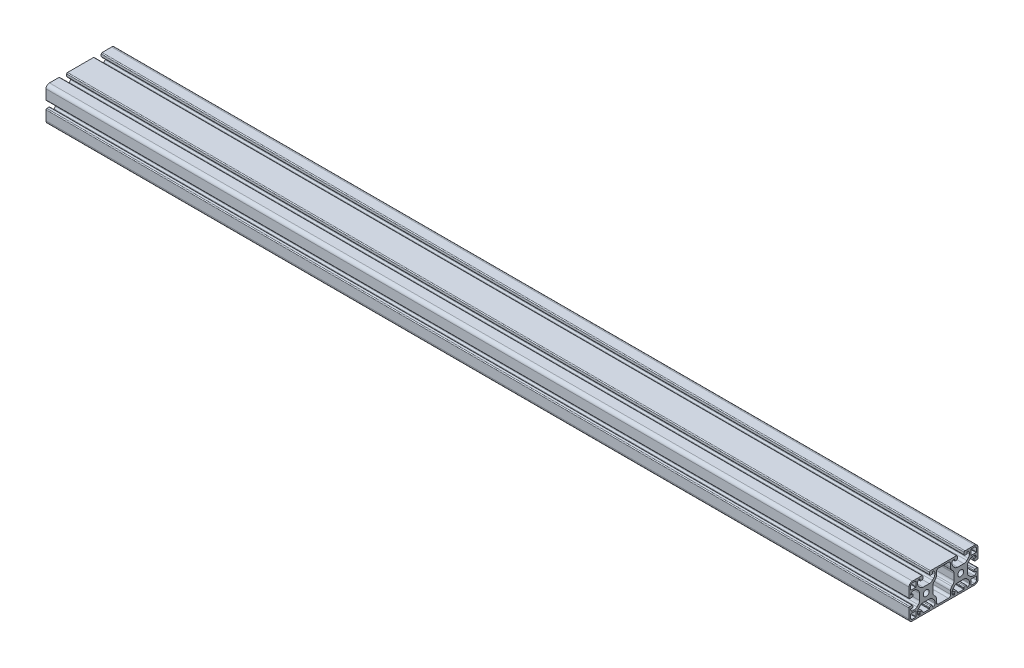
SolidWorks part; units mm, degrees
ref_plane "Ebene vorne" through (0, 0, 0) normal (0, 0, 1) x (1, 0, 0)
ref_plane "Ebene oben" through (0, 0, 0) normal (0, 1, 0) x (1, 0, 0)
ref_plane "Ebene rechts" through (0, 0, 0) normal (1, 0, 0) x (0, 0, -1)
sketch "Skizze1" plane through (0, 0, 0) normal (0, 1, 0) x (1, 0, 0)
  line L0 (0, 0) -> (1000, 0)
  dimension "D1" = 1000
other "Strukturbauteil1"
ref_plane "Ebene3" through (0, 0, 0) normal (1, 0, 0) x (0, 0, -1)
sketch "Model" plane through (0, 0, 0) normal (1, 0, 0) x (0, 0, -1)
  line L0 (-40, 0) -> (40, 0) construction
  line L1 (-20, 20) -> (-20, -20) construction
  line L2 (20, 20) -> (20, -20) construction
  line L3 (10.7855, 7.0931) -> (9.6645, 8.2142)
  line L4 (12.9069, 9.2145) -> (11.4645, 10.6569)
  line L5 (-29.2145, 7.0931) -> (-30.6569, 8.5355)
  line L6 (-11.4645, -10.6569) -> (-12.9069, -9.2145)
  line L7 (-27.0931, 9.2145) -> (-28.5355, 10.6569)
  line L8 (-9.6645, -8.2142) -> (-10.7855, -7.0931)
  line L9 (28.5355, -10.6569) -> (27.0931, -9.2145)
  line L10 (30.6569, -8.5355) -> (29.2145, -7.0931)
  line L11 (-36, -20) -> (36, -20)
  line L12 (32.3, -18.2) -> (36, -18.2)
  line L13 (-36, -18.2) -> (-32.3, -18.2)
  line L14 (-5.7, -18) -> (5.7, -18)
  line L15 (16.5, -18) -> (23.5, -18)
  line L16 (-23.5, -18) -> (-16.5, -18)
  line L17 (13.5, -15.5) -> (15, -15.5)
  line L18 (25, -15.5) -> (26.5, -15.5)
  line L19 (-26.5, -15.5) -> (-25, -15.5)
  line L20 (-15, -15.5) -> (-13.5, -15.5)
  line L21 (32.3, -11.8) -> (37.7, -11.8)
  line L22 (-37.7, -11.8) -> (-32.3, -11.8)
  line L23 (-35.5, -10) -> (-34.1924, -10)
  line L24 (34.1924, -10) -> (35.5, -10)
  line L25 (16.4424, -7.75) -> (23.5576, -7.75)
  line L26 (-23.5576, -7.75) -> (-16.4424, -7.75)
  line L27 (-37.55, -7) -> (-36, -7)
  line L28 (36, -7) -> (37.55, -7)
  line L29 (-39, -4) -> (-36.5, -4)
  line L30 (36.5, -4) -> (39, -4)
  line L31 (-39, 4) -> (-36.5, 4)
  line L32 (36.5, 4) -> (39, 4)
  line L33 (-37.55, 7) -> (-36, 7)
  line L34 (36, 7) -> (37.55, 7)
  line L35 (-23.5576, 7.75) -> (-16.4424, 7.75)
  line L36 (16.4424, 7.75) -> (23.5576, 7.75)
  line L37 (-35.5, 10) -> (-34.1924, 10)
  line L38 (34.1924, 10) -> (35.5, 10)
  line L39 (-37.7, 11.8) -> (-32.3, 11.8)
  line L40 (32.3, 11.8) -> (37.7, 11.8)
  line L41 (-15, 15.5) -> (-13.5, 15.5)
  line L42 (-26.5, 15.5) -> (-25, 15.5)
  line L43 (25, 15.5) -> (26.5, 15.5)
  line L44 (13.5, 15.5) -> (15, 15.5)
  line L45 (-12.55, 18) -> (-12.5, 18)
  line L46 (-27.5, 18) -> (-27.45, 18)
  line L47 (27.45, 18) -> (27.5, 18)
  line L48 (12.5, 18) -> (12.55, 18)
  line L49 (-5.7, 18) -> (5.7, 18)
  line L50 (-36, 18.2) -> (-32.3, 18.2)
  line L51 (32.3, 18.2) -> (36, 18.2)
  line L52 (-15, 20) -> (15, 20)
  line L53 (-36, 20) -> (-25, 20)
  line L54 (25, 20) -> (36, 20)
  line L55 (27.0931, 9.2145) -> (28.5355, 10.6569)
  line L56 (-28.5355, -10.6569) -> (-27.0931, -9.2145)
  line L57 (9.6645, -8.2142) -> (10.7855, -7.0931)
  line L58 (-12.9069, 9.2145) -> (-11.4645, 10.6569)
  line L59 (-30.6569, -8.5355) -> (-29.2145, -7.0931)
  line L60 (11.4645, -10.6569) -> (12.9069, -9.2145)
  line L61 (-10.7855, 7.0931) -> (-9.6645, 8.2142)
  line L62 (29.2145, 7.0931) -> (30.6569, 8.5355)
  line L63 (-40, 5) -> (-40, 16)
  line L64 (-40, -16) -> (-40, -5)
  line L65 (-38.2, 12.3) -> (-38.2, 16)
  line L66 (-38.2, -16) -> (-38.2, -12.3)
  line L67 (-38, 7.45) -> (-38, 7.5)
  line L68 (-38, -7.5) -> (-38, -7.45)
  line L69 (-35.5, 5) -> (-35.5, 6.5)
  line L70 (-35.5, -6.5) -> (-35.5, -5)
  line L71 (-31.8, 12.3) -> (-31.8, 17.7)
  line L72 (-31.8, -17.7) -> (-31.8, -12.3)
  line L73 (-30, 14.1924) -> (-30, 15.5)
  line L74 (-30, -15.5) -> (-30, -14.1924)
  line L75 (-27.75, -3.5576) -> (-27.75, 3.5576)
  line L76 (-27, 16) -> (-27, 17.55)
  line L77 (-27, -17.5) -> (-27, -16)
  line L78 (-24, 16.5) -> (-24, 19)
  line L79 (-24, -17.5) -> (-24, -16.5)
  line L80 (-16, 16.5) -> (-16, 19)
  line L81 (-16, -17.5) -> (-16, -16.5)
  line L82 (-13, 16) -> (-13, 17.55)
  line L83 (-13, -17.5) -> (-13, -16)
  line L84 (-12.25, -3.5576) -> (-12.25, 3.5576)
  line L85 (-10, 14.1924) -> (-10, 15.5)
  line L86 (-10, -15.5) -> (-10, -14.1924)
  line L87 (-8.2, 11.7497) -> (-8.2, 15.5)
  line L88 (-8.2, -15.5) -> (-8.2, -11.7497)
  line L89 (8.2, 11.7497) -> (8.2, 15.5)
  line L90 (8.2, -15.5) -> (8.2, -11.7497)
  line L91 (10, 14.1924) -> (10, 15.5)
  line L92 (10, -15.5) -> (10, -14.1924)
  line L93 (12.25, -3.5576) -> (12.25, 3.5576)
  line L94 (13, 16) -> (13, 17.55)
  line L95 (13, -17.5) -> (13, -16)
  line L96 (16, 16.5) -> (16, 19)
  line L97 (16, -17.5) -> (16, -16.5)
  line L98 (24, 16.5) -> (24, 19)
  line L99 (24, -17.5) -> (24, -16.5)
  line L100 (27, 16) -> (27, 17.55)
  line L101 (27, -17.5) -> (27, -16)
  line L102 (27.75, -3.5576) -> (27.75, 3.5576)
  line L103 (30, 14.1924) -> (30, 15.5)
  line L104 (30, -15.5) -> (30, -14.1924)
  line L105 (31.8, -17.7) -> (31.8, -12.3)
  line L106 (31.8, 12.3) -> (31.8, 17.7)
  line L107 (35.5, -6.5) -> (35.5, -5)
  line L108 (35.5, 5) -> (35.5, 6.5)
  line L109 (38, -7.5) -> (38, -7.45)
  line L110 (38, 7.45) -> (38, 7.5)
  line L111 (38.2, -16) -> (38.2, -12.3)
  line L112 (38.2, 12.3) -> (38.2, 16)
  line L113 (40, -16) -> (40, -5)
  line L114 (40, 5) -> (40, 16)
  line L116 (-40, 20) -> (40, 20) construction
  line L117 (-40, 20) -> (-40, -20) construction
  line L118 (-40, -20) -> (40, -20) construction
  line L119 (40, 20) -> (40, -20) construction
  line L120 (-40, 20) -> (40, -20) construction
  line L121 (-40, -20) -> (40, 20) construction
  arc A0 (-39, -4) -> (-40, -5) centre (-39, -5) ccw
  arc A1 (-40, 5) -> (-39, 4) centre (-39, 5) ccw
  arc A2 (-37.7, -11.8) -> (-38.2, -12.3) centre (-37.7, -12.3) ccw
  arc A3 (-38.2, 12.3) -> (-37.7, 11.8) centre (-37.7, 12.3) ccw
  arc A4 (-37.55, -7) -> (-38, -7.45) centre (-37.55, -7.45) ccw
  arc A5 (-38, 7.45) -> (-37.55, 7) centre (-37.55, 7.45) ccw
  arc A6 (-35.5, -5) -> (-36.5, -4) centre (-36.5, -5) ccw
  arc A7 (-36.5, 4) -> (-35.5, 5) centre (-36.5, 5) ccw
  arc A8 (-38.2, -16) -> (-36, -18.2) centre (-36, -16) ccw
  arc A9 (-40, -16) -> (-36, -20) centre (-36, -16) ccw
  arc A10 (-36, -7) -> (-35.5, -6.5) centre (-36, -6.5) ccw
  arc A11 (-35.5, 6.5) -> (-36, 7) centre (-36, 6.5) ccw
  arc A12 (-36, 18.2) -> (-38.2, 16) centre (-36, 16) ccw
  arc A13 (-36, 20) -> (-40, 16) centre (-36, 16) ccw
  arc A14 (-38, -7.5) -> (-35.5, -10) centre (-35.5, -7.5) ccw
  arc A15 (-35.5, 10) -> (-38, 7.5) centre (-35.5, 7.5) ccw
  arc A16 (-34.1924, -10) -> (-30.6569, -8.5355) centre (-34.1924, -5) ccw
  arc A17 (-30.6569, 8.5355) -> (-34.1924, 10) centre (-34.1924, 5) ccw
  arc A18 (-29.2145, -7.0931) -> (-27.75, -3.5576) centre (-32.75, -3.5576) ccw
  arc A19 (-27.75, 3.5576) -> (-29.2145, 7.0931) centre (-32.75, 3.5576) ccw
  arc A20 (-32.3, -18.2) -> (-31.8, -17.7) centre (-32.3, -17.7) ccw
  arc A21 (-31.8, -12.3) -> (-32.3, -11.8) centre (-32.3, -12.3) ccw
  arc A22 (-32.3, 11.8) -> (-31.8, 12.3) centre (-32.3, 12.3) ccw
  arc A23 (-31.8, 17.7) -> (-32.3, 18.2) centre (-32.3, 17.7) ccw
  arc A24 (-27.5, -18) -> (-27, -17.5) centre (-27.5, -17.5) ccw
  arc A25 (-30, -15.5) -> (-27.5, -18) centre (-27.5, -15.5) ccw
  arc A26 (-27.5, 18) -> (-30, 15.5) centre (-27.5, 15.5) ccw
  arc A27 (-27, 17.55) -> (-27.45, 18) centre (-27.45, 17.55) ccw
  arc A28 (-26.5, -15.5) -> (-27, -16) centre (-26.5, -16) ccw
  arc A29 (-27, 16) -> (-26.5, 15.5) centre (-26.5, 16) ccw
  arc A30 (-24, -16.5) -> (-25, -15.5) centre (-25, -16.5) ccw
  arc A31 (-28.5355, -10.6569) -> (-30, -14.1924) centre (-25, -14.1924) ccw
  arc A32 (-30, 14.1924) -> (-28.5355, 10.6569) centre (-25, 14.1924) ccw
  arc A33 (-25, 15.5) -> (-24, 16.5) centre (-25, 16.5) ccw
  arc A34 (-24, 19) -> (-25, 20) centre (-25, 19) ccw
  arc A35 (-23.5576, -7.75) -> (-27.0931, -9.2145) centre (-23.5576, -12.75) ccw
  arc A36 (-27.0931, 9.2145) -> (-23.5576, 7.75) centre (-23.5576, 12.75) ccw
  arc A37 (-24, -17.5) -> (-23.5, -18) centre (-23.5, -17.5) ccw
  circle A38 centre (-20, 0) radius 3.4
  arc A39 (-16.5, -18) -> (-16, -17.5) centre (-16.5, -17.5) ccw
  arc A40 (-12.9069, -9.2145) -> (-16.4424, -7.75) centre (-16.4424, -12.75) ccw
  arc A41 (-16.4424, 7.75) -> (-12.9069, 9.2145) centre (-16.4424, 12.75) ccw
  arc A42 (-15, -15.5) -> (-16, -16.5) centre (-15, -16.5) ccw
  arc A43 (-10, -14.1924) -> (-11.4645, -10.6569) centre (-15, -14.1924) ccw
  arc A44 (-11.4645, 10.6569) -> (-10, 14.1924) centre (-15, 14.1924) ccw
  arc A45 (-16, 16.5) -> (-15, 15.5) centre (-15, 16.5) ccw
  arc A46 (-15, 20) -> (-16, 19) centre (-15, 19) ccw
  arc A47 (-13, -16) -> (-13.5, -15.5) centre (-13.5, -16) ccw
  arc A48 (-13.5, 15.5) -> (-13, 16) centre (-13.5, 16) ccw
  arc A49 (-8.2, -11.7497) -> (-9.6645, -8.2142) centre (-13.2, -11.7497) ccw
  arc A50 (-9.6645, 8.2142) -> (-8.2, 11.7497) centre (-13.2, 11.7497) ccw
  arc A51 (-12.55, 18) -> (-13, 17.55) centre (-12.55, 17.55) ccw
  arc A52 (-13, -17.5) -> (-12.5, -18) centre (-12.5, -17.5) ccw
  arc A53 (-12.5, -18) -> (-10, -15.5) centre (-12.5, -15.5) ccw
  arc A54 (-10, 15.5) -> (-12.5, 18) centre (-12.5, 15.5) ccw
  arc A55 (-12.25, -3.5576) -> (-10.7855, -7.0931) centre (-7.25, -3.5576) ccw
  arc A56 (-10.7855, 7.0931) -> (-12.25, 3.5576) centre (-7.25, 3.5576) ccw
  arc A57 (-8.2, -15.5) -> (-5.7, -18) centre (-5.7, -15.5) ccw
  arc A58 (-5.7, 18) -> (-8.2, 15.5) centre (-5.7, 15.5) ccw
  arc A59 (5.7, -18) -> (8.2, -15.5) centre (5.7, -15.5) ccw
  arc A60 (8.2, 15.5) -> (5.7, 18) centre (5.7, 15.5) ccw
  arc A61 (10.7855, -7.0931) -> (12.25, -3.5576) centre (7.25, -3.5576) ccw
  arc A62 (12.25, 3.5576) -> (10.7855, 7.0931) centre (7.25, 3.5576) ccw
  arc A63 (12.5, -18) -> (13, -17.5) centre (12.5, -17.5) ccw
  arc A64 (10, -15.5) -> (12.5, -18) centre (12.5, -15.5) ccw
  arc A65 (12.5, 18) -> (10, 15.5) centre (12.5, 15.5) ccw
  arc A66 (13, 17.55) -> (12.55, 18) centre (12.55, 17.55) ccw
  arc A67 (9.6645, -8.2142) -> (8.2, -11.7497) centre (13.2, -11.7497) ccw
  arc A68 (8.2, 11.7497) -> (9.6645, 8.2142) centre (13.2, 11.7497) ccw
  arc A69 (13.5, -15.5) -> (13, -16) centre (13.5, -16) ccw
  arc A70 (13, 16) -> (13.5, 15.5) centre (13.5, 16) ccw
  arc A71 (16, -16.5) -> (15, -15.5) centre (15, -16.5) ccw
  arc A72 (11.4645, -10.6569) -> (10, -14.1924) centre (15, -14.1924) ccw
  arc A73 (10, 14.1924) -> (11.4645, 10.6569) centre (15, 14.1924) ccw
  arc A74 (15, 15.5) -> (16, 16.5) centre (15, 16.5) ccw
  arc A75 (16, 19) -> (15, 20) centre (15, 19) ccw
  arc A76 (16.4424, -7.75) -> (12.9069, -9.2145) centre (16.4424, -12.75) ccw
  arc A77 (12.9069, 9.2145) -> (16.4424, 7.75) centre (16.4424, 12.75) ccw
  arc A78 (16, -17.5) -> (16.5, -18) centre (16.5, -17.5) ccw
  circle A79 centre (20, 0) radius 3.4
  arc A80 (23.5, -18) -> (24, -17.5) centre (23.5, -17.5) ccw
  arc A81 (27.0931, -9.2145) -> (23.5576, -7.75) centre (23.5576, -12.75) ccw
  arc A82 (23.5576, 7.75) -> (27.0931, 9.2145) centre (23.5576, 12.75) ccw
  arc A83 (25, -15.5) -> (24, -16.5) centre (25, -16.5) ccw
  arc A84 (30, -14.1924) -> (28.5355, -10.6569) centre (25, -14.1924) ccw
  arc A85 (28.5355, 10.6569) -> (30, 14.1924) centre (25, 14.1924) ccw
  arc A86 (24, 16.5) -> (25, 15.5) centre (25, 16.5) ccw
  arc A87 (25, 20) -> (24, 19) centre (25, 19) ccw
  arc A88 (27, -16) -> (26.5, -15.5) centre (26.5, -16) ccw
  arc A89 (26.5, 15.5) -> (27, 16) centre (26.5, 16) ccw
  arc A90 (27.45, 18) -> (27, 17.55) centre (27.45, 17.55) ccw
  arc A91 (27, -17.5) -> (27.5, -18) centre (27.5, -17.5) ccw
  arc A92 (27.5, -18) -> (30, -15.5) centre (27.5, -15.5) ccw
  arc A93 (30, 15.5) -> (27.5, 18) centre (27.5, 15.5) ccw
  arc A94 (31.8, -17.7) -> (32.3, -18.2) centre (32.3, -17.7) ccw
  arc A95 (32.3, -11.8) -> (31.8, -12.3) centre (32.3, -12.3) ccw
  arc A96 (31.8, 12.3) -> (32.3, 11.8) centre (32.3, 12.3) ccw
  arc A97 (32.3, 18.2) -> (31.8, 17.7) centre (32.3, 17.7) ccw
  arc A98 (27.75, -3.5576) -> (29.2145, -7.0931) centre (32.75, -3.5576) ccw
  arc A99 (29.2145, 7.0931) -> (27.75, 3.5576) centre (32.75, 3.5576) ccw
  arc A100 (30.6569, -8.5355) -> (34.1924, -10) centre (34.1924, -5) ccw
  arc A101 (34.1924, 10) -> (30.6569, 8.5355) centre (34.1924, 5) ccw
  arc A102 (35.5, -10) -> (38, -7.5) centre (35.5, -7.5) ccw
  arc A103 (38, 7.5) -> (35.5, 10) centre (35.5, 7.5) ccw
  arc A104 (36, -18.2) -> (38.2, -16) centre (36, -16) ccw
  arc A105 (36, -20) -> (40, -16) centre (36, -16) ccw
  arc A106 (35.5, -6.5) -> (36, -7) centre (36, -6.5) ccw
  arc A107 (36, 7) -> (35.5, 6.5) centre (36, 6.5) ccw
  arc A108 (38.2, 16) -> (36, 18.2) centre (36, 16) ccw
  arc A109 (40, 16) -> (36, 20) centre (36, 16) ccw
  arc A110 (36.5, -4) -> (35.5, -5) centre (36.5, -5) ccw
  arc A111 (35.5, 5) -> (36.5, 4) centre (36.5, 5) ccw
  arc A112 (38, -7.45) -> (37.55, -7) centre (37.55, -7.45) ccw
  arc A113 (37.55, 7) -> (38, 7.45) centre (37.55, 7.45) ccw
  arc A114 (38.2, -12.3) -> (37.7, -11.8) centre (37.7, -12.3) ccw
  arc A115 (37.7, 11.8) -> (38.2, 12.3) centre (37.7, 12.3) ccw
  arc A116 (40, -5) -> (39, -4) centre (39, -5) ccw
  arc A117 (39, 4) -> (40, 5) centre (39, 5) ccw
  point P350 (0, 0)
  point P356 (0, -20)
  point P357 (-20, 20)
  point P358 (-40, 0)
  point P359 (20, 20)
  point P360 (40, 0)
  point P361 (0, 0)
  point P362 (-20, -20)
  point P363 (20, -20)
